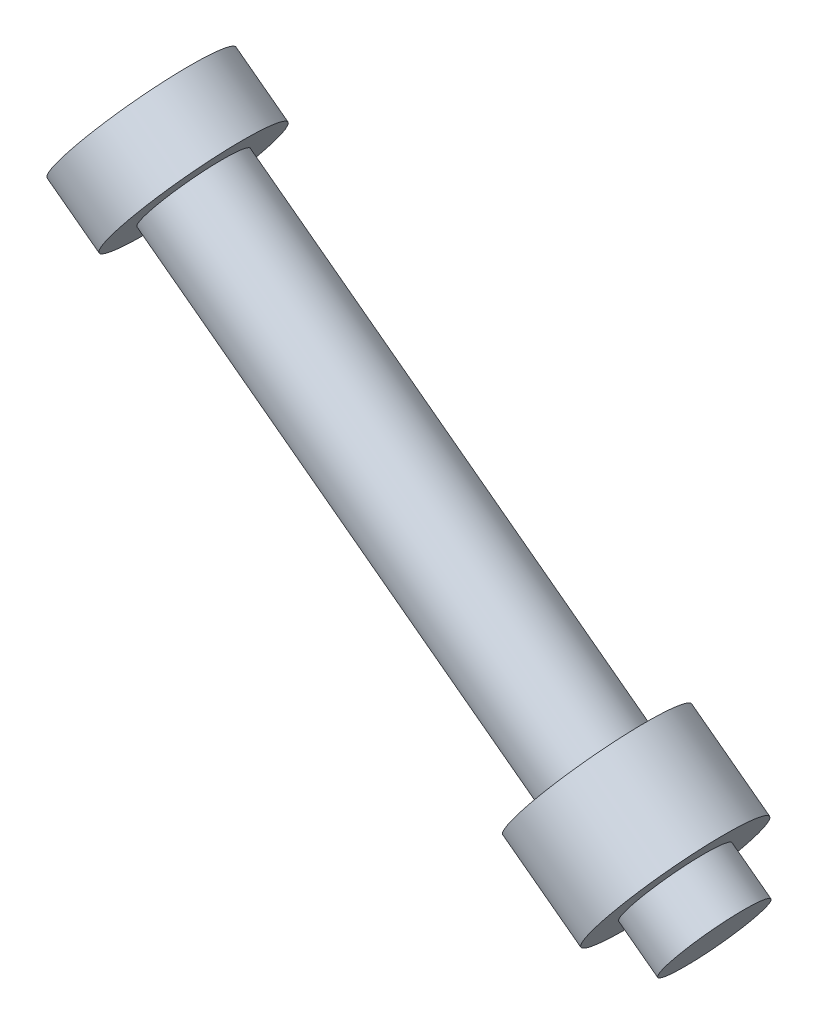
SolidWorks part; units mm, degrees
ref_plane "Alzado" through (0, 0, 0) normal (0, 0, 1) x (1, 0, 0)
ref_plane "Planta" through (0, 0, 0) normal (0, 1, 0) x (1, 0, 0)
ref_plane "Vista lateral" through (0, 0, 0) normal (1, 0, 0) x (0, 0, -1)
sketch3d "Sk_Cabeza"
  line L0 (-234.9749, 359.1356, 0) -> (-238.1775, 361.5322, 0)
  dimension "D1" = 4
sweep "Cabeza" add path "Sk_Cabeza" parameters "D3"=10
sketch3d "Sk_Vastago"
  line L0 (-202.9487, 335.1706, 0) -> (-234.9749, 359.1356, 0)
  dimension "D1" = 40
sweep "Vastago" add path "Sk_Vastago" parameters "D3"=6
sketch3d "Sk_Tuerca"
  line L0 (-205.3507, 336.968, 0) -> (-210.1546, 340.5627, 0)
  dimension "D1" = 6
sweep "Tuerca" add path "Sk_Tuerca" parameters "D3"=10
